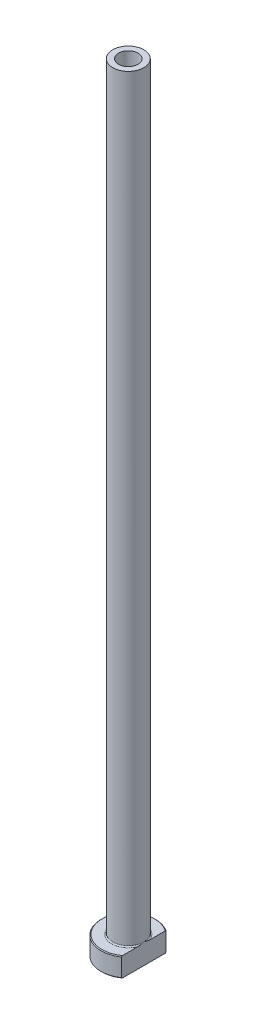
SolidWorks part; units mm, degrees
ref_plane "Front Plane" through (0, 0, 0) normal (0, 0, 1) x (1, 0, 0)
ref_plane "Top Plane" through (0, 0, 0) normal (0, 1, 0) x (1, 0, 0)
ref_plane "Right Plane" through (0, 0, 0) normal (1, 0, 0) x (0, 0, -1)
sketch "Sketch1" plane through (0, 0, 0) normal (0, 0, 1) x (1, 0, 0)
  line L0 (-2.5, 200) -> (-4, 200)
  line L1 (-4, 200) -> (-4, 5)
  line L2 (-4, 5) -> (-7, 5)
  line L3 (-7, 5) -> (-7, 0)
  line L4 (6.05, 0) -> (-6.05, 0) construction
  line L5 (-7, 0) -> (-2.75, 0)
  line L6 (-2.5, 155) -> (-2.5, 200)
  line L7 (0, 92.1877) -> (0, -15.5353) construction
  line L8 (0, -7.7) -> (0, 7.7) construction
  line L9 (-2.5, 155) -> (-2.75, 143)
  line L10 (-2.75, 143) -> (-2.75, 0)
  dimension "D1" = 0.25
  dimension "ID" = 5
  dimension "OD" = 8
  dimension "L" = 200
  dimension "H" = 14
  dimension "T" = 5
  dimension "N" = 45
  dimension "D2" = 12
  dimension "L-N" = 155
revolve "Revolve1" add sketch "Sketch1" angle 360 about L7
fillet "Fillet1" radius 0.3 1 edges at (0, 5, 4)
chamfer "Chamfer1" distance 0.2 angle 45 2 edges at (0, 5, 7) (0, 0, 7)
sketch "Sketch2" plane through (0, 0, 0) normal (0, -1, 0) x (1, 0, 0)
  line L0 (4, 5.7446) -> (4, -5.7446)
  circle A0 centre (0, 0) radius 7 construction
  arc A1 (4, 5.7446) -> (4, -5.7446) centre (0, 0) cw
  circle A2 centre (0, 0) radius 4 construction
extrude "Cut-Extrude1" cut sketch "Sketch2" against normal through all
chamfer "Chamfer2" distance 0.5 angle 45 1 edges at (0, 0, 2.75)
